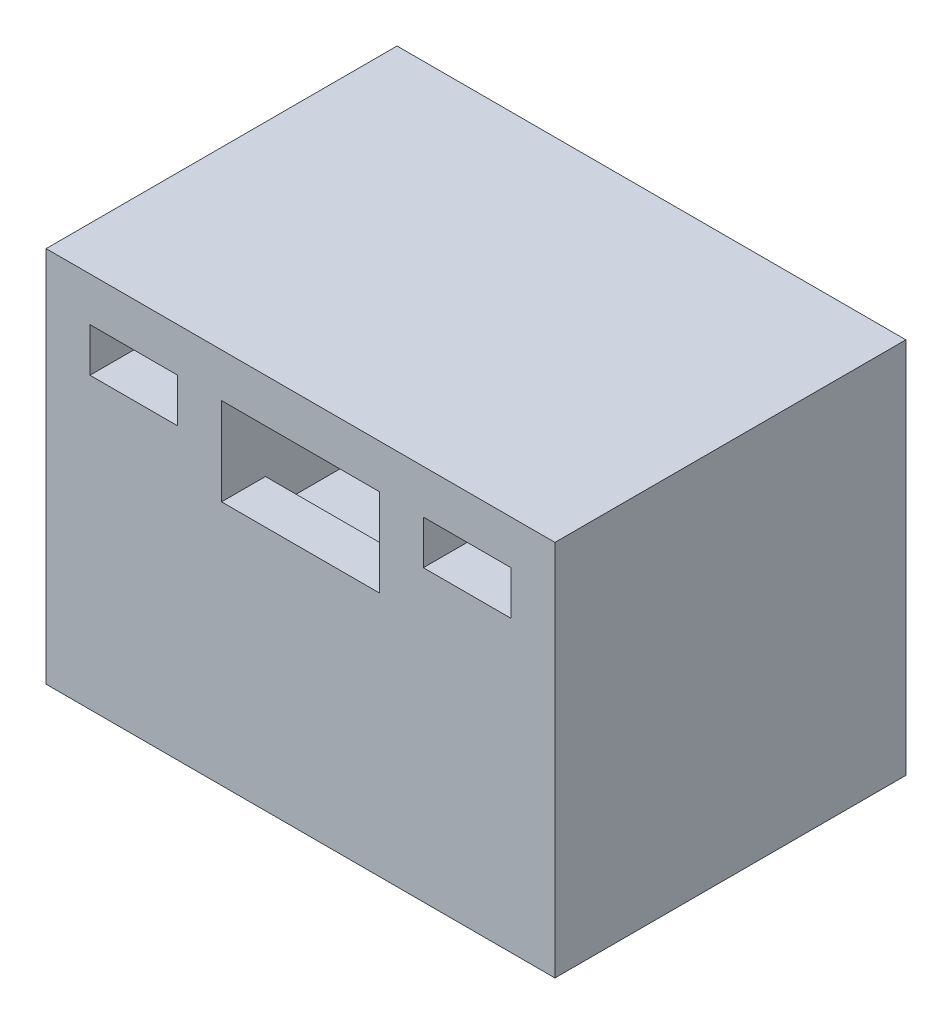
SolidWorks part; units mm, degrees
ref_plane "前视基准面" through (0, 0, 0) normal (0, 0, 1) x (1, 0, 0)
ref_plane "上视基准面" through (0, 0, 0) normal (0, 1, 0) x (1, 0, 0)
ref_plane "右视基准面" through (0, 0, 0) normal (1, 0, 0) x (0, 0, -1)
sketch "草图1" plane through (0, 0, 0) normal (0, 0, 1) x (1, 0, 0)
  line L0 (0, 4.3394) -> (0, -4.6386) construction
  line L1 (-2.9, 2.15) -> (2.9, 2.15)
  line L2 (-2.9, 2.15) -> (-2.9, -2.15)
  line L3 (-2.9, -2.15) -> (2.9, -2.15)
  line L4 (2.9, 2.15) -> (2.9, -2.15)
  line L5 (-2.9, 2.15) -> (2.9, -2.15) construction
  line L6 (-2.9, -2.15) -> (2.9, 2.15) construction
  line L7 (1.4, -0.1994) -> (-1.4, -0.1994)
  line L8 (-2.4, 1.65) -> (-1.4, 1.65)
  line L9 (-2.4, 1.65) -> (-2.4, 1.15)
  line L10 (-2.4, 1.15) -> (-1.4, 1.15)
  line L11 (-1.4, 1.65) -> (-1.4, 1.15)
  line L12 (0.9, 1.65) -> (-0.9, 1.65)
  line L13 (2.4, 0.65) -> (2.4, -1.65)
  line L14 (0.9, 0.3006) -> (-0.9, 0.3006)
  line L15 (-0.9, 1.65) -> (-0.9, 0.3006)
  line L16 (-1.4, -0.1994) -> (-1.4, 0.65)
  line L17 (-1.4, 0.65) -> (-2.4, 0.65)
  line L18 (-2.4, 0.65) -> (-2.4, -1.65)
  line L19 (-2.4, -1.65) -> (2.4, -1.65)
  line L20 (1.4, 0.65) -> (2.4, 0.65)
  line L21 (1.4, -0.1994) -> (1.4, 0.65)
  line L22 (0.9, 1.65) -> (0.9, 0.3006)
  line L23 (1.4, 1.65) -> (1.4, 1.15)
  line L24 (2.4, 1.15) -> (1.4, 1.15)
  line L25 (2.4, 1.65) -> (2.4, 1.15)
  line L26 (2.4, 1.65) -> (1.4, 1.65)
  point P0 (0, 0)
  point P12 (-2.4, 1.4)
  point P15 (0, 1.65)
  point P22 (0, 0.3006)
  point P25 (0, -1.65)
  point P30 (0, 0.3006)
  point P34 (0, -0.1994)
  dimension "D1" = 4.3
  dimension "D2" = 0.5
  dimension "D3" = 1
  dimension "D4" = 0.5
  dimension "D5" = 0.5
  dimension "D6" = 0.5
  dimension "D7" = 0.5
  dimension "D8" = 0.5
  dimension "D9" = 0.5
  dimension "D10" = 0.5
  dimension "D11" = 0.3006
  dimension "D12" = 1.3494
  dimension "D13" = 5.8
extrude "凸台-拉伸1" add sketch "草图1" along normal blind 4
sketch "草图2" plane through (0, 0, 4) normal (0, 0, 1) x (1, 0, 0)
  line L1 (-2.4, 0.65) -> (2.4, 0.65)
  line L2 (-2.4, 0.65) -> (-2.4, -1.65)
  line L3 (-2.4, -1.65) -> (2.4, -1.65)
  line L4 (2.4, 0.65) -> (2.4, -1.65)
extrude "凸台-拉伸2" add sketch "草图2" against normal blind 0.5
